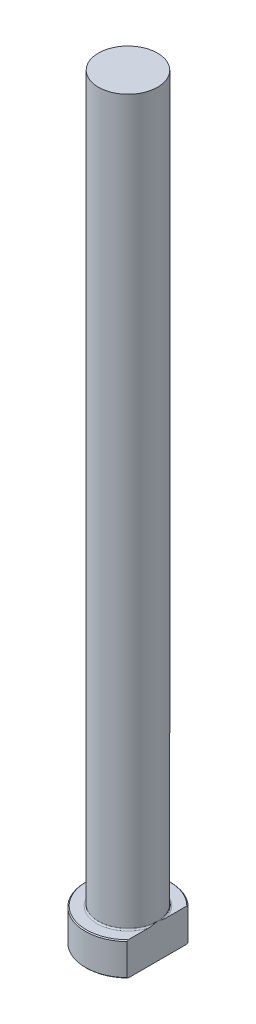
SolidWorks part; units mm, degrees
ref_plane "Front Plane" through (0, 0, 0) normal (0, 0, 1) x (1, 0, 0)
ref_plane "Top Plane" through (0, 0, 0) normal (0, 1, 0) x (1, 0, 0)
ref_plane "Right Plane" through (0, 0, 0) normal (1, 0, 0) x (0, 0, -1)
sketch "Sketch1" plane through (0, 0, 0) normal (0, 0, 1) x (1, 0, 0)
  line L0 (0, 259.9588) -> (0, -15.1925) construction
  line L1 (0, 0) -> (-9, 0)
  line L2 (-9, 0) -> (-9, 7)
  line L3 (-9, 7) -> (-6.25, 7)
  line L4 (-6.25, 7) -> (-6.25, 160)
  line L5 (-6.25, 160) -> (0, 160)
  line L6 (0, 160) -> (0, 0)
  dimension "L" = 160
  dimension "H" = 18
  dimension "T" = 7
  dimension "D" = 12.5
revolve "Revolve1" add sketch "Sketch1" angle 360 about L0
chamfer "Chamfer1" distance 0.2 angle 45 2 edges at (0, 7, 9) (0, 0, 9)
fillet "Fillet1" radius 0.3 1 edges at (0, 7, 6.25)
sketch "Sketch2" plane through (0, 0, 0) normal (0, 1, 0) x (1, 0, 0)
  line L0 (6.25, 6.4759) -> (6.25, -6.4759)
  circle A0 centre (0, 0) radius 9 construction
  arc A1 (6.25, -6.4759) -> (6.25, 6.4759) centre (0, 0) ccw
  circle A2 centre (0, 0) radius 6.25 construction
extrude "KEY" cut sketch "Sketch2" along normal through all
